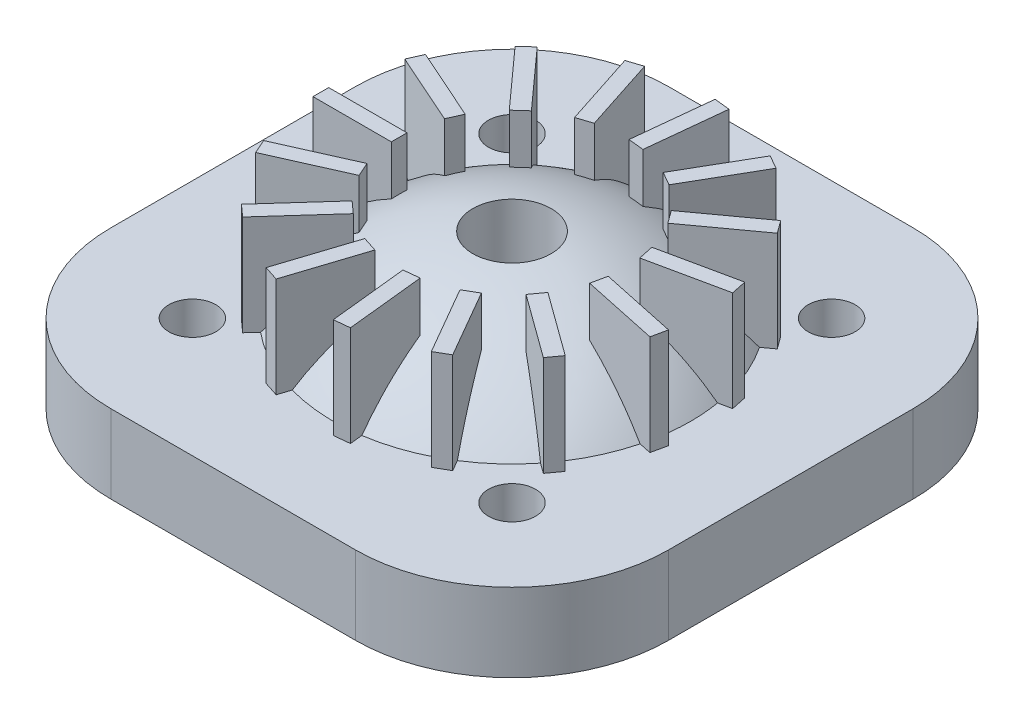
SolidWorks part; units mm, degrees
ref_plane "Front Plane" through (0, 0, 0) normal (0, 0, 1) x (1, 0, 0)
ref_plane "Top Plane" through (0, 0, 0) normal (0, 1, 0) x (1, 0, 0)
ref_plane "Right Plane" through (0, 0, 0) normal (1, 0, 0) x (0, 0, -1)
sketch "Sketch1" plane through (0, 0, 0) normal (0, 1, 0) x (1, 0, 0)
  line L1 (-39, 89) -> (39, 89)
  line L2 (-89, 39) -> (-89, -39)
  line L3 (-39, -89) -> (39, -89)
  line L4 (89, 39) -> (89, -39)
  line L5 (-89, 89) -> (89, -89) construction
  line L6 (-89, -89) -> (89, 89) construction
  arc A0 (-39, 89) -> (-89, 39) centre (-39, 39) ccw
  arc A1 (-89, -39) -> (-39, -89) centre (-39, -39) ccw
  arc A2 (39, -89) -> (89, -39) centre (39, -39) ccw
  arc A3 (39, 89) -> (89, 39) centre (39, 39) cw
  point P0 (0, 0)
  dimension "D3" = 50
  dimension "D1" = 178
  dimension "D2" = 178
extrude "Boss-Extrude1" add sketch "Sketch1" along normal blind 25 contours L1 A3 L4 A2 L3 A1 L2 A0
sketch "Sketch6" plane through (0, 0, 0) normal (0, -1, 0) x (1, 0, 0)
  line L0 (-31.5, 82.4444) -> (31.5, 82.4444) construction
  line L1 (82.4444, -31.5) -> (82.4444, 31.5) construction
  line L3 (89, -39) -> (89, 39) construction
  circle A21 centre (0, 0) radius 45
  arc A22 (61.1982, 44.6757) -> (44.6757, 61.1982) centre (51, 51) ccw
  arc A23 (-61.1982, 44.6757) -> (-44.6757, 61.1982) centre (-51, 51) cw
  arc A24 (-61.1982, -44.6757) -> (-44.6757, -61.1982) centre (-51, -51) ccw
  arc A25 (61.1982, -44.6757) -> (44.6757, -61.1982) centre (51, -51) cw
  arc A26 (57.9871, 26.3191) -> (57.9871, -26.3191) centre (-66.2558, 0) cw
  arc A27 (57.9871, 26.3191) -> (61.1982, 44.6757) centre (82.4444, 31.5) cw
  arc A28 (57.9871, -26.3191) -> (61.1982, -44.6757) centre (82.4444, -31.5) ccw
  circle A29 centre (51, 51) radius 7.5
  circle A30 centre (-51, 51) radius 7.5
  circle A31 centre (-51, -51) radius 7.5
  circle A32 centre (51, -51) radius 7.5
  arc A33 (-57.9871, -26.3191) -> (-61.1982, -44.6757) centre (-82.4444, -31.5) cw
  arc A34 (-57.9871, 26.3191) -> (-57.9871, -26.3191) centre (66.2558, 0) ccw
  arc A35 (-57.9871, 26.3191) -> (-61.1982, 44.6757) centre (-82.4444, 31.5) ccw
  arc A36 (26.3191, 57.9871) -> (-26.3191, 57.9871) centre (0, -66.2558) ccw
  arc A37 (-26.3191, 57.9871) -> (-44.6757, 61.1982) centre (-31.5, 82.4444) cw
  arc A38 (26.3191, 57.9871) -> (44.6757, 61.1982) centre (31.5, 82.4444) ccw
  arc A39 (26.3191, -57.9871) -> (44.6757, -61.1982) centre (31.5, -82.4444) cw
  arc A40 (26.3191, -57.9871) -> (-26.3191, -57.9871) centre (0, 66.2558) cw
  arc A41 (-26.3191, -57.9871) -> (-44.6757, -61.1982) centre (-31.5, -82.4444) ccw
  dimension "D1" = 90
  dimension "D2" = 15
  dimension "D3" = 12
  dimension "D4" = 127
  dimension "D5" = 25
  dimension "D6" = 6.5556
  dimension "D7" = 22.7442
  dimension "D8" = 27.8018
  dimension "D9" = 31.0129
  dimension "D10" = 6.5556
extrude "Boss-Extrude2" add sketch "Sketch6" along normal blind 6.5
sketch "Sketch7" plane through (0, 0, 0) normal (0, 0, 1) x (1, 0, 0)
  line L0 (0, 25) -> (0, 50)
  line L1 (-39, 25) -> (39, 25) construction
  line L2 (0, -13.75) -> (0, 13.75) construction
  line L3 (89, 25) -> (39, 25) construction
  line L4 (0, 25) -> (57, 25)
  arc A0 (0, 50) -> (57, 25) centre (0.6503, -25.9972) cw
  dimension "D3" = 76
  dimension "D1" = 25
  dimension "D2" = 57
revolve "Revolve1" add sketch "Sketch7" angle 360 about L0
sketch "Sketch8" plane through (0, 0, 0) normal (0, 0, 1) x (1, 0, 0)
  line L0 (0, -6.5) -> (0, 18.5)
  line L1 (-26.3191, -6.5) -> (26.3191, -6.5) construction
  line L2 (0, -13.75) -> (0, 13.75) construction
  line L3 (0, -6.5) -> (57, -6.5)
  arc A1 (0, 18.5) -> (57, -6.5) centre (0.6503, -57.4972) cw
  dimension "D3" = 76
  dimension "D1" = 25
  dimension "D2" = 57
revolve "Cut-Revolve1" cut sketch "Sketch8" angle 360 about L0
sketch "Sketch10" plane through (0, -6.5, 0) normal (0, -1, 0) x (1, 0, 0)
  circle A0 centre (-51, 51) radius 7.5 construction
  circle A1 centre (-51, -51) radius 7.5 construction
  circle A2 centre (51, -51) radius 7.5 construction
  circle A3 centre (51, 51) radius 7.5 construction
  circle A4 centre (-51, 51) radius 7.5
  circle A5 centre (-51, -51) radius 7.5
  circle A6 centre (51, -51) radius 7.5
  circle A7 centre (51, 51) radius 7.5
  circle A8 centre (0, 0) radius 12.5
  dimension "D1" = 25
extrude "Cut-Extrude1" cut sketch "Sketch10" against normal through all
ref_plane "Plane1" through (0, 57, 0) normal (0, 1, 0) x (1, 0, 0)
sketch "Sketch11" plane through (0, 57, 0) normal (0, 1, 0) x (1, 0, 0)
  line L0 (-31.0765, 0) -> (31.0765, 0) construction
  line L1 (-61, 2.5) -> (-36, 2.5)
  line L2 (-61, 2.5) -> (-61, -2.5)
  line L3 (-61, -2.5) -> (-36, -2.5)
  line L4 (-36, 2.5) -> (-36, -2.5)
  dimension "D1" = 25
  dimension "D2" = 5
  dimension "D3" = 2.5
  dimension "D4" = 36
extrude "Boss-Extrude3" add sketch "Sketch11" against normal up to next
pattern_circular "CirPattern1" count 15 over 360 about axis through (0, 0, 0) along (0, 1, 0) of "Boss-Extrude3"
